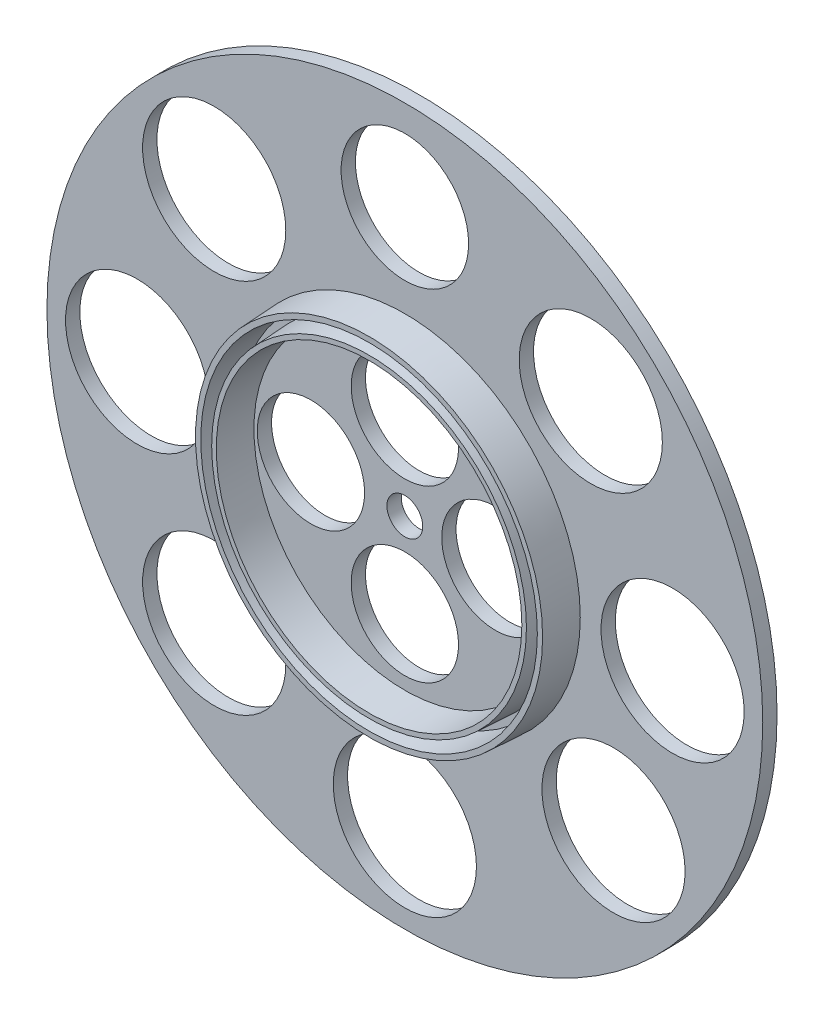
SolidWorks part; units mm, degrees
ref_plane "Front Plane" through (0, 0, 0) normal (0, 0, 1) x (1, 0, 0)
ref_plane "Top Plane" through (0, 0, 0) normal (0, 1, 0) x (1, 0, 0)
ref_plane "Right Plane" through (0, 0, 0) normal (1, 0, 0) x (0, 0, -1)
sketch "Sketch1" plane through (0, 0, 0) normal (0, 0, 1) x (1, 0, 0)
  circle A0 centre (0, 0) radius 50
  dimension "D1" = 100
extrude "Boss-Extrude1" add sketch "Sketch1" along normal blind 2
sketch "Sketch2" plane through (0, 0, 2) normal (0, 0, 1) x (1, 0, 0)
  circle A0 centre (0, 0) radius 22.25
  circle A2 centre (0, 0) radius 21.0812
  dimension "D1" = 44.5
extrude "Boss-Extrude2" add sketch "Sketch2" along normal blind 5 draft 3
sketch "Sketch3" plane through (0, 0, 2) normal (0, 0, 1) x (1, 0, 0)
  circle A0 centre (0, 0) radius 23.25
  circle A1 centre (0, 0) radius 24.5077
  dimension "D1" = 46.5
extrude "Boss-Extrude3" add sketch "Sketch3" along normal blind 5 draft 3
sketch "Sketch4" plane through (0, 0, 2) normal (0, 0, 1) x (1, 0, 0)
  circle A0 centre (0, 0) radius 2.5
  circle A1 centre (0, 11.9987) radius 7.5
  circle A2 centre (0, 37.4021) radius 8.9067
  circle A3 centre (-26.6342, 26.2591) radius 10
  circle A4 centre (-37.4021, 0) radius 10
  circle A5 centre (0, -37.4021) radius 10
  circle A6 centre (37.4021, 0) radius 10
  circle A7 centre (25.9743, 26.912) radius 10
  circle A8 centre (29.1512, -23.4334) radius 10
  circle A9 centre (-26.6342, -26.2591) radius 10
  circle A10 centre (0, -11.8112) radius 7.5
  circle A11 centre (-13.1235, 0) radius 7.5
  circle A12 centre (12.6548, 0) radius 7.5
  dimension "D1" = 5
  dimension "D2" = 20
  dimension "D3" = 20
  dimension "D4" = 17.8135
  dimension "D5" = 20
  dimension "D6" = 20
  dimension "D7" = 20
  dimension "D8" = 20
  dimension "D9" = 20
  dimension "D10" = 15
  dimension "D11" = 15
  dimension "D12" = 15
  dimension "D13" = 15
extrude "Cut-Extrude1" cut sketch "Sketch4" against normal through all
equation "\"obodnarupa\"=20"
equation "\"D2@Sketch4\"=\"obodnarupa\""
equation "\"D3@Sketch4\"=\"obodnarupa\""
equation "\"D5@Sketch4\"=\"obodnarupa\""
equation "\"D6@Sketch4\"=\"obodnarupa\""
equation "\"D7@Sketch4\"=\"obodnarupa\""
equation "\"D8@Sketch4\"=\"obodnarupa\""
equation "\"D9@Sketch4\"=\"obodnarupa\""
